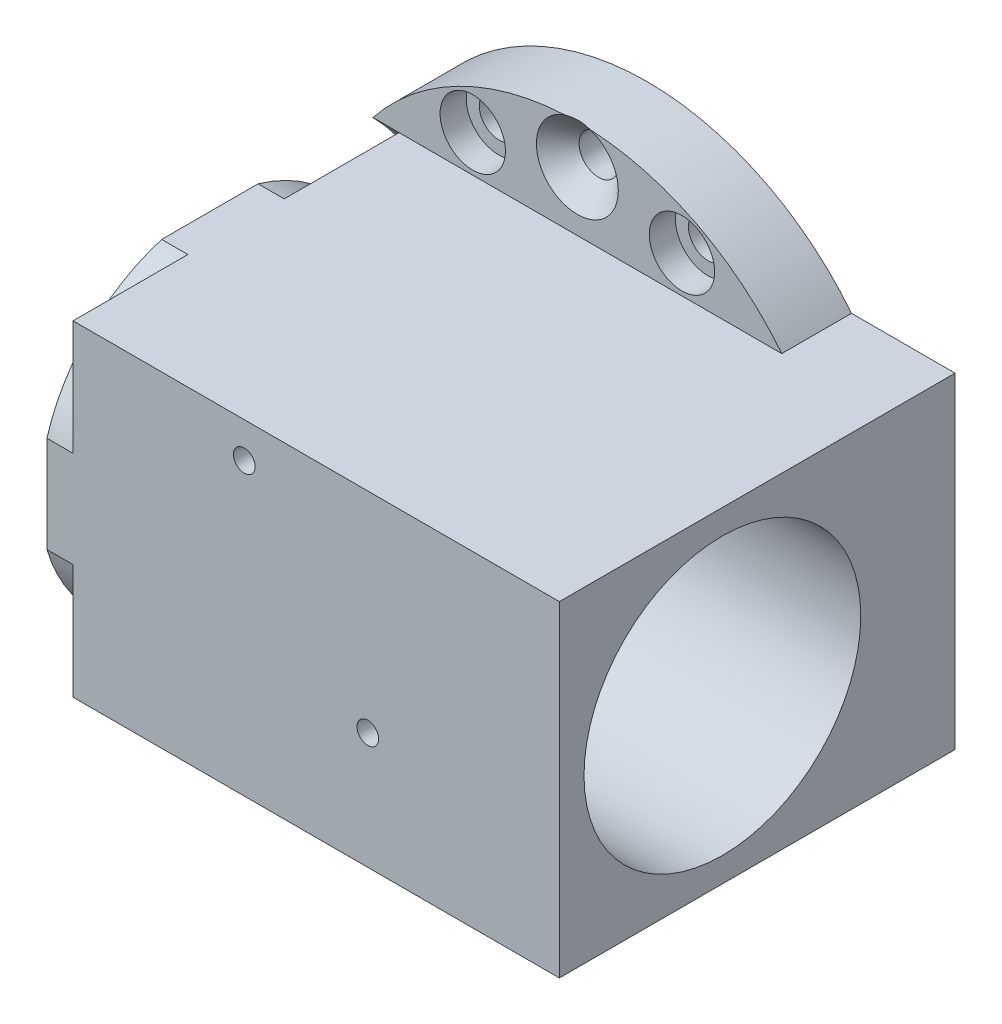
SolidWorks part; units mm, degrees
ref_plane "Front Plane" through (0, 0, 0) normal (0, 0, 1) x (1, 0, 0)
ref_plane "Top Plane" through (0, 0, 0) normal (0, 1, 0) x (1, 0, 0)
ref_plane "Right Plane" through (0, 0, 0) normal (1, 0, 0) x (0, 0, -1)
ref_plane "Plane1" through (0, 0, 8) normal (0, 0, 1) x (1, 0, 0)
sketch "Sketch1" plane through (0, 0, 8) normal (0, 0, 1) x (1, 0, 0)
  line L0 (-23.4587, 18.7) -> (-23.4587, -18.7)
  line L1 (23.4587, -18.7) -> (35.3413, -18.7)
  line L2 (35.3413, -18.7) -> (35.3413, 18.7)
  line L3 (35.3413, 18.7) -> (23.4587, 18.7)
  arc A0 (-23.4587, -18.7) -> (23.4587, -18.7) centre (0, 0) ccw
  arc A1 (23.4587, 18.7) -> (-23.4587, 18.7) centre (0, 0) ccw
extrude "Boss-Extrude1" add sketch "Sketch1" against normal blind 8
ref_plane "Plane2" through (-23.4587, 0, 0) normal (-1, 0, 0) x (0, -1, 0)
ref_plane "Plane3" through (-20.4587, 0, 0) normal (1, 0, 0) x (0, 0, -1)
sketch "Sketch3" plane through (-20.4587, 0, 0) normal (1, 0, 0) x (0, 0, -1)
  line L0 (-8, 18.7) -> (-8, -18.7)
  arc A0 (-8, -18.7) -> (-8, 18.7) centre (-26.7, 0) ccw
extrude "Cut-Extrude1" cut sketch "Sketch3" against normal up to surface
sketch "Sketch4" plane through (0, 0, 8) normal (0, 0, 1) x (1, 0, 0)
  line L0 (-20.4587, -18.7) -> (-20.4587, 18.7)
  line L1 (-20.4587, 18.7) -> (35.3413, 18.7)
  line L2 (35.3413, 18.7) -> (35.3413, -18.7)
  line L3 (35.3413, -18.7) -> (-20.4587, -18.7)
extrude "Boss-Extrude2" add sketch "Sketch4" along normal blind 37.4
sketch "Sketch5" plane through (-20.4587, 0, 0) normal (-1, 0, 0) x (0, 0, 1)
  line L0 (21.1719, 18.7) -> (45.4, 18.7)
  line L1 (45.4, 18.7) -> (45.4, -18.7)
  line L2 (45.4, -18.7) -> (21.1719, -18.7)
  arc A0 (21.1719, -18.7) -> (21.1719, 18.7) centre (26.7, 0) cw
extrude "Boss-Extrude3" add sketch "Sketch5" along normal blind 3
sketch "Sketch6" plane through (-23.4587, 0, 0) normal (-1, 0, 0) x (0, 0, 1)
  line L0 (45.4, -18.7) -> (45.4, -5.5281)
  line L1 (32.2281, -18.7) -> (45.4, -18.7)
  arc A0 (45.4, -5.5281) -> (32.2281, -18.7) centre (26.7, 0) cw
extrude "Cut-Extrude2" cut sketch "Sketch6" against normal blind 3
sketch "Sketch7" plane through (-23.4587, 0, 0) normal (-1, 0, 0) x (0, 0, 1)
  line L0 (45.4, 18.7) -> (32.2281, 18.7)
  line L1 (45.4, 5.5281) -> (45.4, 18.7)
  arc A0 (32.2281, 18.7) -> (45.4, 5.5281) centre (26.7, 0) cw
extrude "Cut-Extrude3" cut sketch "Sketch7" against normal blind 3
ref_plane "Plane4" through (0, 0, 26.7) normal (0, 0, 1) x (1, 0, 0)
sketch "Sketch8" plane through (0, 0, 26.7) normal (0, 0, 1) x (1, 0, 0)
  line L0 (-23.4587, 15.875) -> (-23.4587, 0)
  line L1 (-23.4587, 0) -> (35.3413, 0)
  line L2 (35.3413, 0) -> (35.3413, 15.875)
  line L3 (35.3413, 15.875) -> (9.9413, 15.875)
  line L4 (9.9413, 15.875) -> (9.9413, 13.5)
  line L5 (9.9413, 13.5) -> (1.9413, 13.5)
  line L6 (1.9413, 13.5) -> (1.9413, 15.875)
  line L7 (1.9413, 15.875) -> (-23.4587, 15.875)
  line L8 (-23.4587, 0) -> (35.3413, 0) construction
revolve "Cut-Revolve1" cut sketch "Sketch8" angle 360 about L8
hole_wizard "CSK for #8 Flat Head Machine Screw (100)1" positions "Sketch10" profile "Sketch9" countersink size "#8" standard "ANSI Inch"
sketch "Sketch10" plane through (0, 0, 8) normal (0, 0, 1) x (1, 0, 0)
  point P0 (0, 25.5)
  point P1 (0, -25.5)
sketch "Sketch9" plane through (0, 25.5, 8) normal (1, 0, 0) x (0, -1, 0)
  line L0 (0, 0) -> (0, 8)
  line L1 (0, 8) -> (2.25, 8)
  line L2 (2.25, 8) -> (2.25, 2.45)
  line L3 (2.25, 2.45) -> (4.7, 0)
  line L5 (4.7, 0) -> (0, 0)
  line L6 (-2.25, 2.45) -> (-4.7, 0) construction
  line L11 (0, -6.35) -> (0, 107.95) construction
  dimension "Thru Hole Dia." = 4.5
  dimension "Thru Hole Depth" = 8
  dimension "Near C'Sink Dia." = 9.4
  dimension "Near C'Sink Angle" = 90
hole_wizard "#4 Clearance Hole1" positions "Sketch12" profile "Sketch11" hole size "#4" standard "ANSI Inch"
sketch "Sketch12" plane through (0, -18.7, 0) normal (0, -1, 0) x (-1, 0, 0)
  point P0 (12.4587, -39.4)
  point P1 (-29.4413, -39.4)
  point P2 (-29.4413, -5.9)
sketch "Sketch11" plane through (-12.4587, -18.7, 39.4) normal (1, 0, 0) x (0, 0, -1)
  line L0 (0, 0) -> (0, 6)
  line L1 (0, 6) -> (1.65, 6)
  line L2 (1.65, 6) -> (1.65, 0)
  line L5 (1.65, 0) -> (0, 0)
  line L10 (0, 6) -> (-1.65, 6) construction
  line L11 (0, -6.35) -> (0, 107.95) construction
  dimension "Hole Dia." = 3.3
  dimension "Hole Depth" = 6
  dimension "Drill Angle" = 180
hole_wizard "CBORE for #8 Binding Head Machine Screw1" positions "Sketch14" profile "Sketch13" counterbore size "#8" standard "ANSI Inch"
sketch "Sketch14" plane through (0, 0, 8) normal (0, 0, 1) x (1, 0, 0)
  point P0 (12, 22.95)
  point P1 (-12, 22.95)
  point P2 (-12, -22.95)
  point P3 (12, -22.95)
sketch "Sketch13" plane through (12, 22.95, 8) normal (1, 0, 0) x (0, -1, 0)
  line L0 (0, 0) -> (0, 8)
  line L1 (0, 8) -> (2.25, 8)
  line L3 (2.25, 8) -> (2.25, 3)
  line L4 (2.25, 3) -> (3.75, 3)
  line L5 (3.75, 3) -> (3.75, 0)
  line L7 (3.75, 0) -> (0, 0)
  line L11 (0, -6.35) -> (0, 107.95) construction
  dimension "Thru Hole Dia." = 4.5
  dimension "Thru Hole Depth" = 8
  dimension "C'Bore Dia." = 7.5
  dimension "C'Bore Depth" = 3
hole_wizard "#2 Clearance Hole1" positions "Sketch16" profile "Sketch15" hole size "#2" standard "ANSI Inch"
sketch "Sketch16" plane through (0, 0, 45.4) normal (0, 0, 1) x (1, 0, 0)
  point P0 (-0.8087, 14.63)
sketch "Sketch15" plane through (-0.8087, 14.63, 45.4) normal (1, 0, 0) x (0, -1, 0)
  line L0 (0, 0) -> (0, 6)
  line L1 (0, 6) -> (1.25, 6)
  line L2 (1.25, 6) -> (1.25, 0)
  line L5 (1.25, 0) -> (0, 0)
  line L10 (0, 6) -> (-1.25, 6) construction
  line L11 (0, -6.35) -> (0, 107.95) construction
  dimension "Hole Dia." = 2.5
  dimension "Hole Depth" = 6
  dimension "Drill Angle" = 180
hole_wizard "#2 Clearance Hole2" positions "Sketch18" profile "Sketch17" hole size "#2" standard "ANSI Inch"
sketch "Sketch18" plane through (0, 0, 45.4) normal (0, 0, 1) x (1, 0, 0)
  point P0 (13.3613, -5.33)
sketch "Sketch17" plane through (13.3613, -5.33, 45.4) normal (1, 0, 0) x (0, -1, 0)
  line L0 (0, 0) -> (0, 3.7465)
  line L1 (0, 3.7465) -> (1.25, 3.7465)
  line L2 (1.25, 3.7465) -> (1.25, 0)
  line L5 (1.25, 0) -> (0, 0)
  line L11 (0, -6.35) -> (0, 107.95) construction
  dimension "Thru Hole Dia." = 2.5
  dimension "Thru Hole Depth" = 3.7465
